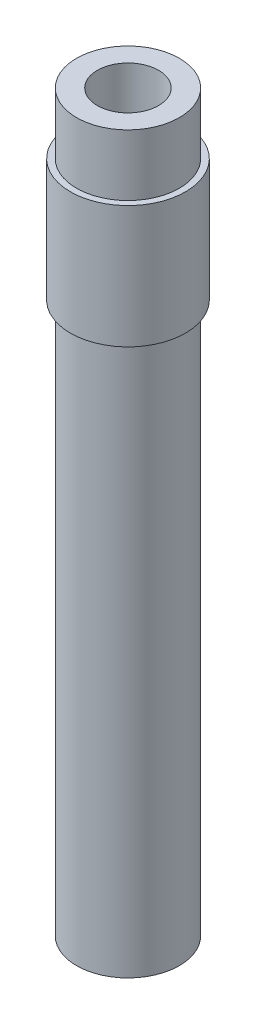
SolidWorks part; units mm, degrees
ref_plane "Front Plane" through (0, 0, 0) normal (0, 0, 1) x (1, 0, 0)
ref_plane "Top Plane" through (0, 0, 0) normal (0, 1, 0) x (1, 0, 0)
ref_plane "Right Plane" through (0, 0, 0) normal (1, 0, 0) x (0, 0, -1)
sketch "Sketch1" plane through (0, 0, 0) normal (0, 1, 0) x (1, 0, 0)
  circle A0 centre (0, 0) radius 6.35
  circle A1 centre (0, 0) radius 10.668
  dimension "D1" = 21.336
  dimension "D2" = 12.7
extrude "Boss-Extrude1" add sketch "Sketch1" along normal blind 152.4
sketch "Sketch2" plane through (0, 0, 0) normal (0, 0, 1) x (1, 0, 0)
  line L0 (10.668, 0) -> (10.668, 152.4) construction
  line L1 (10.668, 0) -> (10.668, 152.4)
  line L2 (10.668, 139.7) -> (11.938, 139.7)
  line L3 (11.938, 139.7) -> (11.938, 114.3)
  line L4 (11.938, 114.3) -> (10.668, 114.3)
  line L5 (0, 152.4) -> (0, 0) construction
  line L6 (10.668, 152.4) -> (-10.668, 152.4) construction
  dimension "D1" = 1.27
  dimension "D2" = 25.4
  dimension "D3" = 12.7
revolve "Revolve1" add sketch "Sketch2" angle 360 about L5
